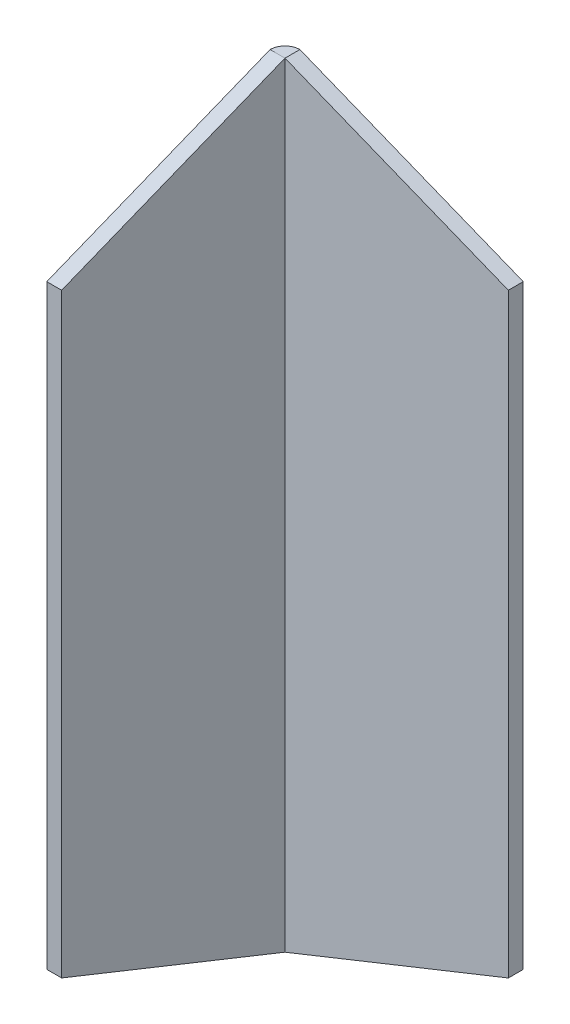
SolidWorks part; units mm, degrees
ref_plane "Front Plane" through (0, 0, 0) normal (0, 0, 1) x (1, 0, 0)
ref_plane "Top Plane" through (0, 0, 0) normal (0, 1, 0) x (1, 0, 0)
ref_plane "Right Plane" through (0, 0, 0) normal (1, 0, 0) x (0, 0, -1)
sketch "Sketch1" plane through (0, 0, 0) normal (0, 0, 1) x (1, 0, 0)
  line L0 (0, 0) -> (0, 52) construction
  line L1 (0, 52) -> (15, 46)
  line L2 (15, 46) -> (15, 6)
  line L3 (15, 6) -> (0, 0)
  line L4 (-15, 6) -> (0, 0)
  line L5 (-15, 46) -> (-15, 6)
  line L6 (0, 52) -> (-15, 46)
  dimension "D1" = 15
  dimension "D2" = 52
  dimension "D3" = 6
  dimension "D4" = 6
sheet metal parameters "Sheet-Metal1" thickness 1 parameters "D1"=1
base flange "Base-Flange1" sketch "Sketch1" thickness 1 reverse thickness direction yes parameters "D1"=1
sketch "Sketch3" plane through (0, 0, 1) normal (0, 0, 1) x (1, 0, 0)
  line L0 (0, 52) -> (0, 0)
  line L1 (0, 52) -> (-15, 46) construction
sketched bend "Sketched Bend1" parameters "D1"=0.001
bend "SketchBend1" bend radius 0.001 bend angle 90 parameters "D5"=1
flat pattern "Flat-Pattern1"
sketch "Bend-Lines1" plane through (0, 0, 0) normal (0, 1, 0) x (-1, 0, 0)
bend of the flat pattern "Flatten-<SketchBend1>1"
